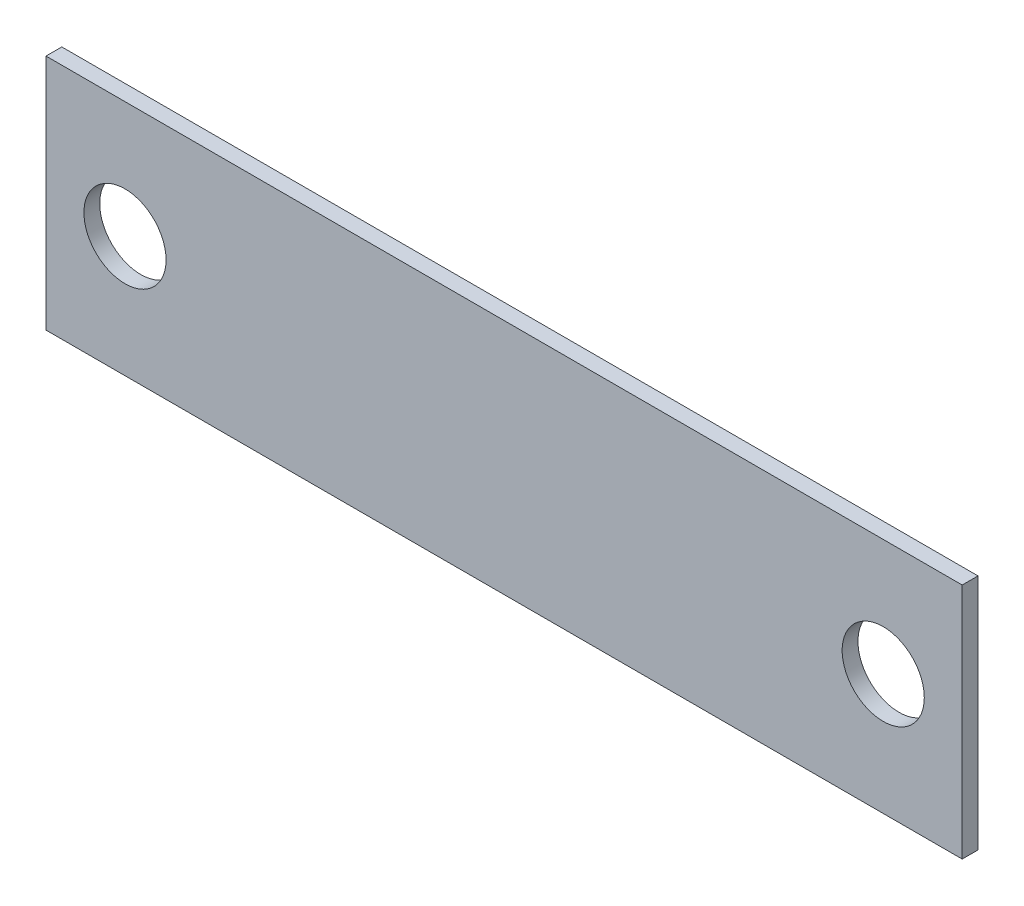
SolidWorks part; units mm, degrees
ref_plane "Plan de face" through (0, 0, 0) normal (0, 0, 1) x (1, 0, 0)
ref_plane "Plan de dessus" through (0, 0, 0) normal (0, 1, 0) x (1, 0, 0)
ref_plane "Plan de droite" through (0, 0, 0) normal (1, 0, 0) x (0, 0, -1)
sketch "Esquisse1" plane through (0, 0, 0) normal (0, 0, 1) x (1, 0, 0)
  line L21 (-61.5105, -121.0608) -> (518.4895, -121.0608)
  line L23 (518.4895, 29.1992) -> (-61.5105, 29.1992)
  line L26 (-61.5105, 29.1992) -> (-61.5105, -121.0608)
  line L27 (518.4895, 29.1992) -> (518.4895, -121.0608)
  dimension "D1" = 580
  dimension "D3" = 580
  dimension "D4" = 150.26
extrude "Boss.-Extru.1" add sketch "Esquisse1" along normal blind 10
sketch "Esquisse2" plane through (0, 0, 10) normal (0, 0, 1) x (1, 0, 0)
  circle A0 centre (-11.5105, -44.6126) radius 26
  circle A1 centre (468.4895, -44.6126) radius 26
  dimension "D1" = 52
  dimension "D2" = 52
  dimension "D3" = 50
  dimension "D4" = 50
extrude "Enlèv. mat.-Extru.1" cut sketch "Esquisse2" against normal blind 10
